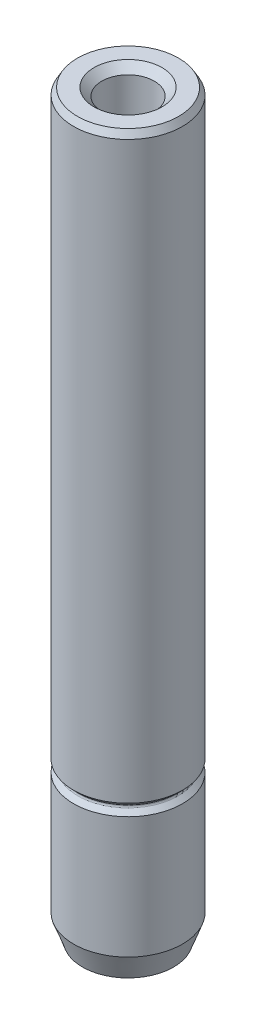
SolidWorks part; units mm, degrees
ref_plane "Front Plane" through (0, 0, 0) normal (0, 0, 1) x (1, 0, 0)
ref_plane "Top Plane" through (0, 0, 0) normal (0, 1, 0) x (1, 0, 0)
ref_plane "Right Plane" through (0, 0, 0) normal (1, 0, 0) x (0, 0, -1)
sketch "Sketch1" plane through (0, 0, 0) normal (0, 0, 1) x (1, 0, 0)
  line L0 (0, 0) -> (0, 12.6681) construction
  line L1 (-2.159, 0) -> (-2.159, 1.6002)
  line L2 (-2.159, 1.6002) -> (-1.7145, 1.6002)
  line L3 (-1.7145, 1.6002) -> (-1.7145, 48.26)
  line L4 (-1.7145, 48.26) -> (-3.556, 48.26)
  line L5 (-3.556, 1.5875) -> (-2.9782, 0)
  line L6 (0, -4.826) -> (0, 0) construction
  line L7 (-3.556, 48.26) -> (-3.556, 10.287)
  line L8 (-2.9782, 0) -> (-2.159, 0)
  line L9 (-3.556, 10.287) -> (-3.175, 9.906)
  line L10 (-3.175, 9.906) -> (-3.556, 9.525)
  line L11 (-3.556, 9.525) -> (-3.556, 1.5875)
  line L12 (-3.556, 9.525) -> (-3.556, 10.287) construction
  line L13 (-3.175, 9.906) -> (-3.556, 9.906) construction
  dimension "D1" = 4.318
  dimension "D2" = 7.112
  dimension "D3" = 1.6002
  dimension "D4" = 48.26
  dimension "D5" = 14.732
  dimension "D6" = 3.429
  dimension "D7" = 20
  dimension "D8" = 0.381
  dimension "D9" = 1.5875
  dimension "D10" = 4.826
revolve "Revolve1" add sketch "Sketch1" angle 360 about L0
chamfer "Chamfer1" distance 0.254 angle 60 1 edges at (0, 48.26, -3.556)
chamfer "Chamfer2" distance 0.508 angle 45 1 edges at (0, 48.26, -1.7145)
sketch "Sketch2" plane through (0, 1.6002, 0) normal (0, -1, 0) x (1, 0, 0)
  circle A0 centre (0, 0) radius 2.413
extrude "Boss-Extrude2" [suppressed] add sketch "Sketch2" along normal offset from surface (8.001 mm away) 4.826
ref_plane "Plane1" through (0, 9.906, 0) normal (0, 1, 0) x (1, 0, 0)
fillet "Fillet1" radius 0.127 1 edges at (0, 9.906, -3.175)
